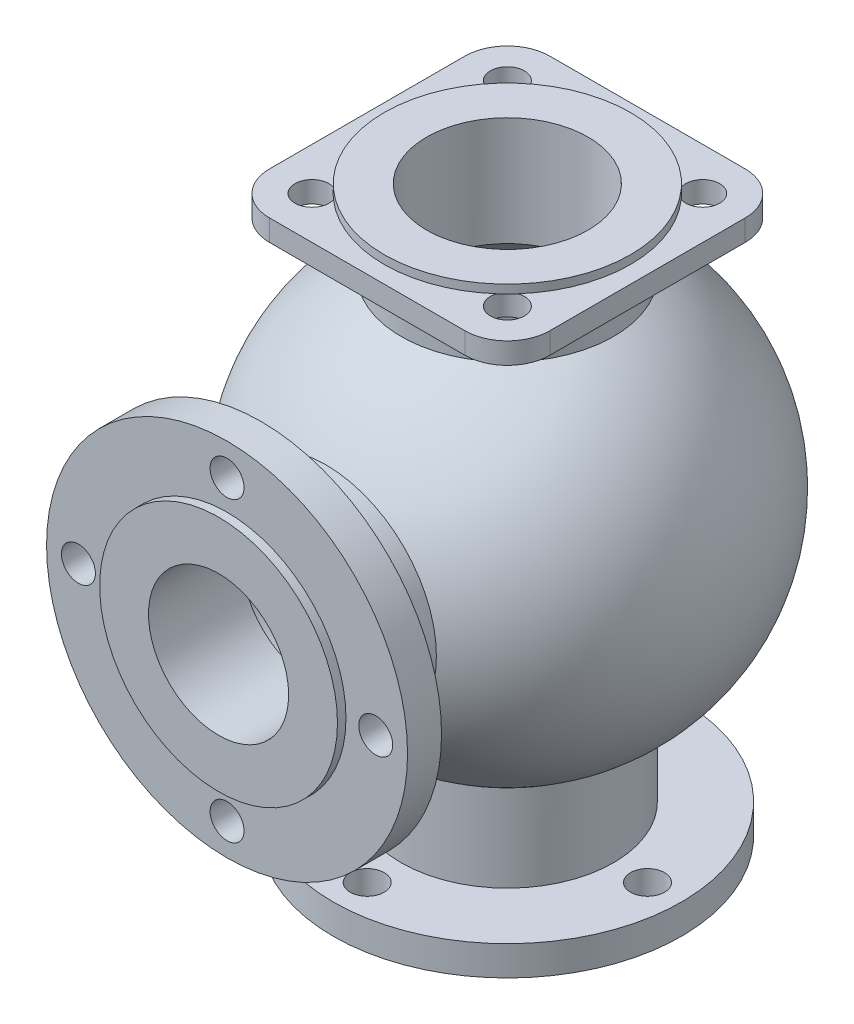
SolidWorks part; units mm, degrees
ref_plane "Front Plane" through (0, 0, 0) normal (0, 0, 1) x (1, 0, 0)
ref_plane "Top Plane" through (0, 0, 0) normal (0, 1, 0) x (1, 0, 0)
ref_plane "Right Plane" through (0, 0, 0) normal (1, 0, 0) x (0, 0, -1)
sketch "Sketch1" plane through (0, 0, 0) normal (1, 0, 0) x (0, 0, -1)
  line L0 (0, 53.7901) -> (0, 41) construction
  line L1 (0, 50) -> (0, 41)
  line L2 (0, -41) -> (0, -59.7795) construction
  line L3 (0, -41) -> (0, -50)
  arc A0 (0, 41) -> (0, -41) centre (0, 0) ccw
  arc A1 (0, 50) -> (0, -50) centre (0, 0) ccw
  circle A2 centre (0, 0) radius 50 construction
  circle A3 centre (0, 0) radius 41 construction
  dimension "D1" = 82
  dimension "D2" = 9
revolve "Revolve1" add sketch "Sketch1" angle 360 about L0
ref_plane "Plane1" through (0, 62, 0) normal (0, 1, 0) x (1, 0, 0)
sketch "Sketch2" plane through (0, 62, 0) normal (0, 1, 0) x (1, 0, 0)
  circle A0 centre (0, 0) radius 29
  dimension "D1" = 58
extrude "Boss-Extrude1" add sketch "Sketch2" against normal blind 2 separate body
sketch "Sketch3" plane through (0, 60, 0) normal (0, -1, 0) x (1, 0, 0)
  line L1 (-23, 33) -> (23, 33)
  line L2 (-33, 23) -> (-33, -23)
  line L3 (-23, -33) -> (23, -33)
  line L4 (33, 23) -> (33, -23)
  line L5 (-33, 33) -> (33, -33) construction
  line L6 (-33, -33) -> (33, 33) construction
  arc A0 (-33, -23) -> (-23, -33) centre (-23, -23) ccw
  arc A1 (23, -33) -> (33, -23) centre (23, -23) ccw
  arc A2 (23, 33) -> (33, 23) centre (23, 23) cw
  arc A3 (-23, 33) -> (-33, 23) centre (-23, 23) ccw
  point P0 (0, 0)
  dimension "D3" = 10
  dimension "D1" = 66
  dimension "D2" = 66
extrude "Boss-Extrude2" add sketch "Sketch3" along normal blind 5
sketch "Sketch4" plane through (0, 55, 0) normal (0, -1, 0) x (1, 0, 0)
  circle A0 centre (0, 0) radius 25
  dimension "D1" = 50
extrude "Boss-Extrude3" add sketch "Sketch4" along normal up to surface (11.6987 mm away)
sketch "Sketch5" plane through (0, 62, 0) normal (0, 1, 0) x (1, 0, 0)
  circle A0 centre (0, 0) radius 19
  dimension "D1" = 38
extrude "Cut-Extrude1" cut sketch "Sketch5" against normal up to next
ref_plane "Plane2" through (0, 0, 68) normal (0, 0, 1) x (1, 0, 0)
sketch "Sketch6" plane through (0, 0, 68) normal (0, 0, 1) x (1, 0, 0)
  circle A0 centre (0, 0) radius 28
  dimension "D1" = 56
extrude "Boss-Extrude4" add sketch "Sketch6" against normal blind 2 separate body
sketch "Sketch7" plane through (0, 0, 66) normal (0, 0, -1) x (-1, 0, 0)
  circle A0 centre (0, 0) radius 42.5
  dimension "D1" = 85
extrude "Boss-Extrude5" add sketch "Sketch7" along normal blind 8
sketch "Sketch8" plane through (0, 0, 58) normal (0, 0, -1) x (-1, 0, 0)
  circle A0 centre (0, 0) radius 26
  dimension "D1" = 52
extrude "Boss-Extrude6" add sketch "Sketch8" along normal up to surface (15.2917 mm away)
sketch "Sketch9" plane through (0, 0, 68) normal (0, 0, 1) x (1, 0, 0)
  circle A0 centre (0, 0) radius 16.5
  dimension "D1" = 33
extrude "Cut-Extrude2" cut sketch "Sketch9" against normal blind 22
sketch "Sketch10" plane through (0, 0, 46) normal (0, 0, 1) x (1, 0, 0)
  circle A0 centre (0, 0) radius 18
  dimension "D1" = 36
extrude "Cut-Extrude3" cut sketch "Sketch10" against normal up to surface (9.1625 mm away)
sketch "Sketch11" plane through (0, 0, 66) normal (0, 0, 1) x (1, 0, 0)
  circle A0 centre (0, 0) radius 35 construction
  circle A3 centre (0, 35) radius 4
  circle A4 centre (35, 0) radius 4
  circle A5 centre (0, -35) radius 4
  circle A6 centre (-35, 0) radius 4
  dimension "D1" = 70
  dimension "D2" = 8
  dimension "D3" = 4
extrude "Cut-Extrude4" cut sketch "Sketch11" against normal up to next
sketch "Sketch20" plane through (0, 60, 0) normal (0, 1, 0) x (1, 0, 0)
  circle A0 centre (-23, 23) radius 4
  circle A1 centre (23, 23) radius 4
  circle A2 centre (23, -23) radius 4
  circle A3 centre (-23, -23) radius 4
  dimension "D1" = 8
extrude "Cut-Extrude5" cut sketch "Sketch20" against normal blind 10
ref_plane "Plane3" through (0, -73, 0) normal (0, 1, 0) x (1, 0, 0)
sketch "Sketch21" plane through (0, -73, 0) normal (0, 1, 0) x (1, 0, 0)
  circle A0 centre (0, 0) radius 27
  dimension "D1" = 54
extrude "Boss-Extrude7" add sketch "Sketch21" along normal blind 2 separate body
sketch "Sketch22" plane through (0, -71, 0) normal (0, 1, 0) x (1, 0, 0)
  circle A0 centre (0, 0) radius 41
  dimension "D1" = 82
extrude "Boss-Extrude8" add sketch "Sketch22" along normal blind 7
sketch "Sketch23" plane through (0, -64, 0) normal (0, 1, 0) x (1, 0, 0)
  circle A0 centre (0, 0) radius 25
  dimension "D1" = 50
extrude "Boss-Extrude9" add sketch "Sketch23" along normal up to next
sketch "Sketch24" plane through (0, -71, 0) normal (0, -1, 0) x (1, 0, 0)
  circle A0 centre (0, 0) radius 33 construction
  circle A1 centre (0, 33) radius 4
  circle A2 centre (33, 0) radius 4
  circle A3 centre (0, -33) radius 4
  circle A4 centre (-33, 0) radius 4
  dimension "D1" = 66
  dimension "D2" = 8
extrude "Cut-Extrude6" cut sketch "Sketch24" against normal up to next
sketch "Sketch25" plane through (0, -73, 0) normal (0, -1, 0) x (1, 0, 0)
  circle A0 centre (0, 0) radius 14
  dimension "D1" = 28
extrude "Cut-Extrude7" cut sketch "Sketch25" against normal blind 19
sketch "Sketch26" plane through (0, -54, 0) normal (0, -1, 0) x (1, 0, 0)
  circle A0 centre (0, 0) radius 19
  dimension "D1" = 38
extrude "Cut-Extrude8" cut sketch "Sketch26" against normal up to next
sketch "Sketch27" plane through (0, 0, 0) normal (1, 0, 0) x (0, 0, -1)
  line L0 (0, 0) -> (83.3111, 0) construction
  line L2 (35.25, -22) -> (44.9, -22)
  line L3 (35.25, -22) -> (35.25, -28)
  line L4 (35.25, -28) -> (44.9, -28)
  line L5 (44.9, -22) -> (44.9, -28)
  dimension "D1" = 9.65
  dimension "D2" = 6
  dimension "D3" = 35.25
  dimension "D4" = 28
revolve "Revolve2" add sketch "Sketch27" angle 360 about L4
sketch "Sketch28" plane through (0, 0, -44.9) normal (0, 0, -1) x (-1, 0, 0)
  circle A0 centre (0, -28) radius 3.5
  dimension "D1" = 7
extrude "Cut-Extrude9" cut sketch "Sketch28" against normal up to next
